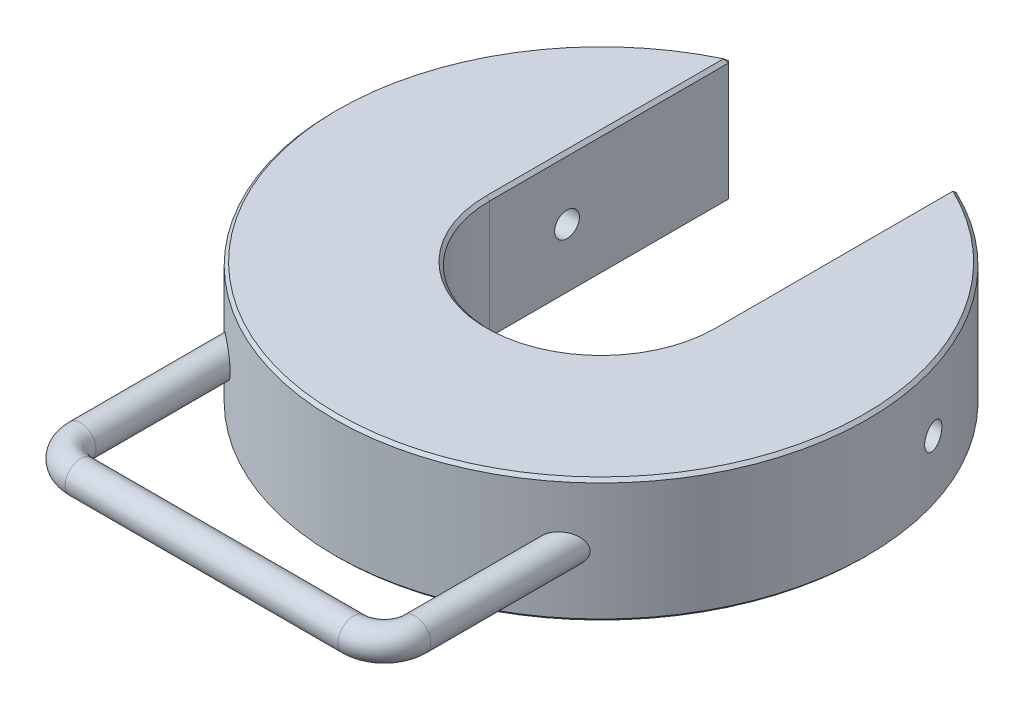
SolidWorks part; units mm, degrees
ref_plane "Face" through (0, 0, 0) normal (0, 0, 1) x (1, 0, 0)
ref_plane "Dessus" through (0, 0, 0) normal (0, 1, 0) x (1, 0, 0)
ref_plane "Droite" through (0, 0, 0) normal (1, 0, 0) x (0, 0, -1)
sketch "Esquisse1" plane through (0, 0, 0) normal (0, 1, 0) x (1, 0, 0)
  line L0 (-36, 0) -> (-36, 78.1025)
  line L1 (36, 0) -> (36, 78.1025)
  arc A0 (-36, 78.1025) -> (36, 78.1025) centre (0, 0) ccw
  arc A1 (-36, 0) -> (36, 0) centre (0, 0) ccw
  dimension "D1" = 172
  dimension "D2" = 72
extrude "Boss.-Extru.1" add sketch "Esquisse1" along normal blind 40
chamfer "Chanfrein1" distance 1 angle 45 10 edges at (-36, 0, -39.0512) (0, 0, 86) (36, 0, -39.0512) (0, 0, 36) (36, 40, -39.0512) (0, 40, 86) (-36, 40, -39.0512) (0, 40, 36) (36, 20, -78.1025) (-36, 20, -78.1025)
sketch "Esquisse4" plane through (0, 0, 0) normal (1, 0, 0) x (0, 0, -1)
  line L0 (77.7845, 20) -> (25, 20) construction
  line L1 (77.7845, 39) -> (77.7845, 1) construction
  circle A0 centre (25, 20) radius 4
  dimension "D1" = 8
  dimension "D2" = 25
extrude "Enlèv. mat.-Extru.1" cut sketch "Esquisse4" against normal through all and the other way through all
ref_plane "Plan1" through (0, 20, 0) normal (0, 1, 0) x (1, 0, 0)
sketch "Esquisse5" plane through (0, 20, 0) normal (0, 1, 0) x (1, 0, 0)
  line L0 (-54, -66.9328) -> (-54, -113.9328)
  line L1 (-44, -123.9328) -> (44, -123.9328)
  line L2 (54, -113.9328) -> (54, -66.9328)
  line L3 (0, 0) -> (0, -85) construction
  arc A0 (-36.682, 77.7845) -> (36.9005, 77.6811) centre (0, 0) ccw construction
  arc A1 (-37, 76.5245) -> (37, 76.5245) centre (0, 0) ccw construction
  arc A2 (-54, -113.9328) -> (-44, -123.9328) centre (-44, -113.9328) ccw
  arc A3 (44, -123.9328) -> (54, -113.9328) centre (44, -113.9328) ccw
  point P15 (-54, -123.9328)
  point P18 (54, -123.9328)
  dimension "D3" = 10
  dimension "D1" = 108
  dimension "D2" = 57
other "Rond Ø  12(1)"
ref_plane "Plan2" through (-54, 20, 66.9328) normal (0, 0, 1) x (1, 0, 0)
sketch "Esquisse11" plane through (-54, 20, 66.9328) normal (0, 0, 1) x (1, 0, 0)
  line L2 (-5, 0) -> (5, 0) construction
  line L7 (0, -5) -> (0, 5) construction
  line L9 (3.5355, 3.5355) -> (-3.5355, -3.5355) construction
  line L10 (-3.5355, 3.5355) -> (3.5355, -3.5355) construction
  circle A1 centre (0, 0) radius 5
  point P0 (0, 0)
  dimension "D1" = 10
other "Ajuster/Prolonger1"
